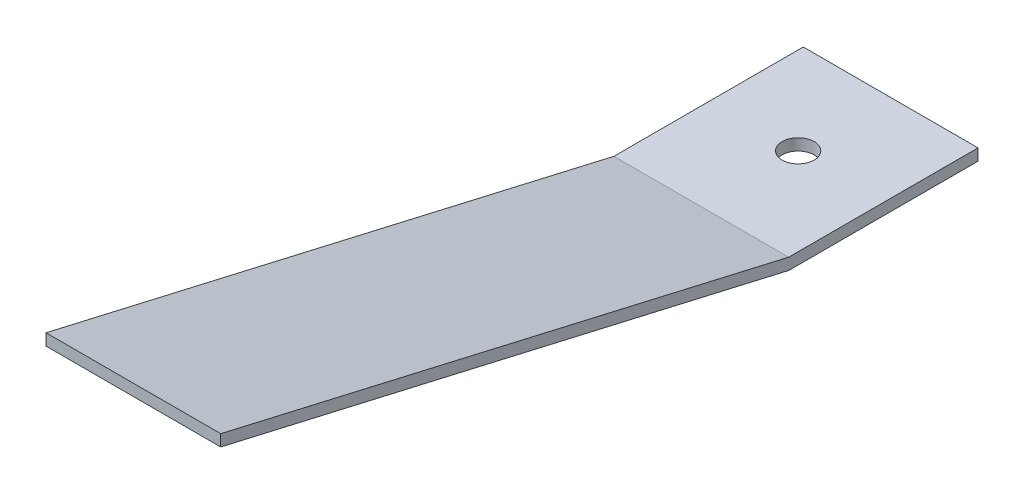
SolidWorks part; units mm, degrees
ref_plane "Front" through (0, 0, 0) normal (0, 0, 1) x (1, 0, 0)
ref_plane "Top" through (0, 0, 0) normal (0, 1, 0) x (1, 0, 0)
ref_plane "Right" through (0, 0, 0) normal (1, 0, 0) x (0, 0, -1)
sketch "Sketch1" plane through (0, 0, 0) normal (0, 1, 0) x (1, 0, 0)
  line L1 (6, -6.5) -> (-6, -6.5)
  line L2 (6, -6.5) -> (6, 6.5)
  line L3 (6, 6.5) -> (-6, 6.5)
  line L4 (-6, -6.5) -> (-6, 6.5)
  line L5 (6, -6.5) -> (-6, 6.5) construction
  line L6 (6, 6.5) -> (-6, -6.5) construction
  point P0 (0, 0)
  dimension "D1" = 13
  dimension "D2" = 12
extrude "Boss-Extrude1" add sketch "Sketch1" along normal blind 0.7937
sketch "Sketch2" plane through (6, 0, 0) normal (1, 0, 0) x (0, 0, -1)
  line L0 (-6.5, 0) -> (-6.5, 0.7937)
  line L1 (-6.5, 0.7937) -> (-45.5, 9.7976)
  line L2 (-45.5, 9.7976) -> (-45.5, 9.0039)
  line L3 (-45.5, 9.0039) -> (-6.5, 0)
  line L4 (-6.5, 0.7937) -> (6.5, 0.7937) construction
  dimension "D1" = 167
  dimension "D2" = 52
extrude "Boss-Extrude2" add sketch "Sketch2" against normal up to vertex (12 mm away)
sketch "Sketch3" plane through (0, 0.7937, 0) normal (0, 1, 0) x (1, 0, 0)
  line L0 (6, 6.5) -> (-6, 6.5) construction
  line L1 (6, -6.5) -> (6, 6.5) construction
  circle A0 centre (0, 0.15) radius 1.1
  dimension "D1" = 2.2
  dimension "D3" = 6
  dimension "D2" = 6.35
extrude "Cut-Extrude1" cut sketch "Sketch3" against normal through all
